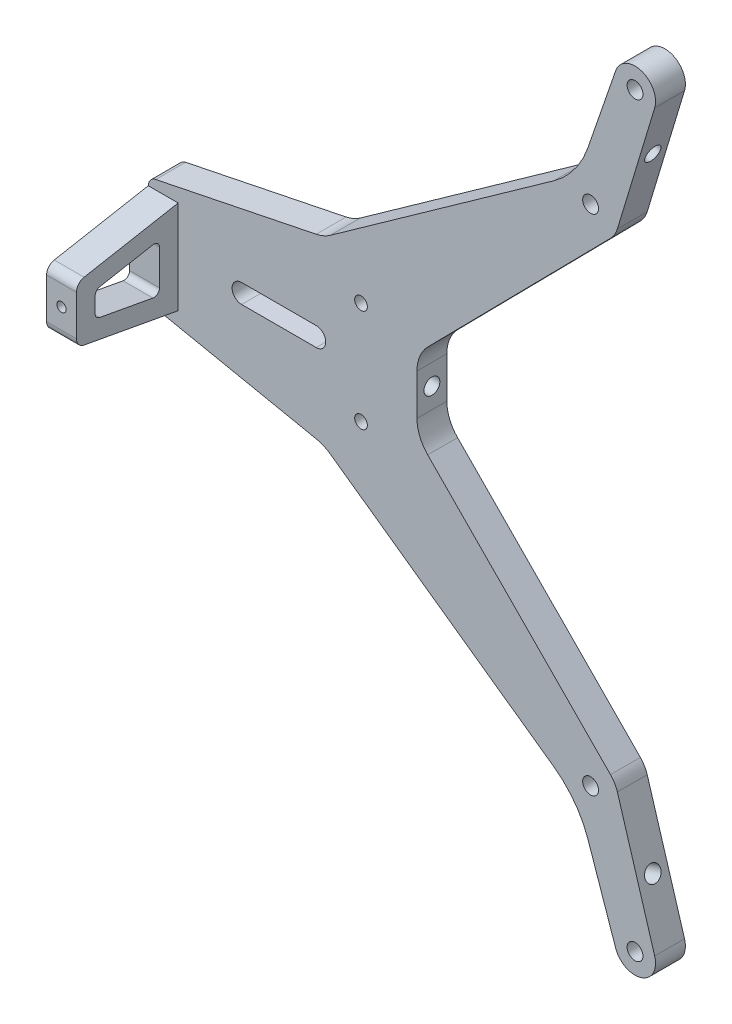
SolidWorks part; units mm, degrees
ref_plane "Plan de face" through (0, 0, 0) normal (0, 0, 1) x (1, 0, 0)
ref_plane "Plan de dessus" through (0, 0, 0) normal (0, 1, 0) x (1, 0, 0)
ref_plane "Plan de droite" through (0, 0, 0) normal (1, 0, 0) x (0, 0, -1)
sketch "Esquisse1" plane through (0, 0, 0) normal (0, 0, 1) x (1, 0, 0)
  line L0 (-218, 25) -> (-218, 15)
  line L1 (-74, 11) -> (-74, -11)
  line L2 (-450.4728, 0) -> (669.2457, 0) construction
  line L3 (-68.2463, 25.0372) -> (29.7295, 124.4721)
  line L4 (-120.4178, 50.796) -> (-0.6967, 135.9513)
  line L5 (33.4035, 130.6608) -> (53.396, 196.8179)
  line L6 (17.597, 160.4129) -> (32.4659, 203.5822)
  line L7 (-214.0025, 29.8985) -> (-128, 47.5)
  line L8 (-218, 15) -> (-202, 15)
  line L9 (-202, 15) -> (-202, -15)
  line L10 (-218, -15) -> (-202, -15)
  line L11 (-214.0025, -29.8985) -> (-128, -47.5)
  line L12 (17.597, -160.4129) -> (32.4659, -203.5822)
  line L13 (33.4035, -130.6608) -> (53.396, -196.8179)
  line L14 (-120.4178, -50.796) -> (-0.6967, -135.9513)
  line L15 (-68.2463, -25.0372) -> (29.7295, -124.4721)
  line L16 (-218, -25) -> (-218, -15)
  circle A0 centre (488, 0) radius 488 construction
  arc A1 (53.396, 196.8179) -> (32.4659, 203.5822) centre (42.8663, 200) ccw
  arc A2 (29.7295, -124.4721) -> (33.4035, -130.6608) centre (19.0448, -135) cw
  arc A3 (-74, 11) -> (-68.2463, 25.0372) centre (-54, 11) cw
  arc A4 (17.597, 160.4129) -> (-0.6967, 135.9513) centre (-29.6774, 176.6958) cw
  arc A5 (-120.4178, 50.796) -> (-128, 47.5) centre (-132.0101, 67.0938) cw
  arc A6 (-214.0025, 29.8985) -> (-218, 25) centre (-213, 25) ccw
  arc A7 (-214.0025, -29.8985) -> (-218, -25) centre (-213, -25) cw
  arc A8 (29.7295, 124.4721) -> (33.4035, 130.6608) centre (19.0448, 135) ccw
  arc A9 (-120.4178, -50.796) -> (-128, -47.5) centre (-132.0101, -67.0938) ccw
  arc A10 (17.597, -160.4129) -> (-0.6967, -135.9513) centre (-29.6774, -176.6958) ccw
  arc A11 (-74, -11) -> (-68.2463, -25.0372) centre (-54, -11) ccw
  arc A12 (53.396, -196.8179) -> (32.4659, -203.5822) centre (42.8663, -200) cw
  point P46 (-202, 0)
  point P47 (-74, 0)
  dimension "D1" = 976
  dimension "D2" = 200
  dimension "D3" = 22
  dimension "D4" = 15
  dimension "D6" = 218
  dimension "D8" = 20
  dimension "D12" = 50
  dimension "D14" = 20
  dimension "D13" = 5
  dimension "D5" = 135
  dimension "D7" = 144
  dimension "D9" = 11
  dimension "D10" = 10
  dimension "D11" = 9
  dimension "D15" = 25
  dimension "D16" = 47.5
  dimension "D17" = 90
  dimension "D18" = 16
  dimension "D19" = 15
extrude "Boss.-Extru.1" add sketch "Esquisse1" along normal mid plane 16
hole_wizard "Trou taraudé M105" positions "Esquisse16" profile "Esquisse15" tap size "M10" standard "Iso"
sketch "Esquisse16" plane through (-33.6613, 11.5941, 0) normal (-0.9455, 0.3257, 0) x (0, 0, 1)
  line L0 (8, 157.399) -> (-8, 157.399) construction
  line L1 (0, -149.5265) -> (0, 149.5265) construction
  point P0 (0, 172.399)
  dimension "D1" = 15
sketch "Esquisse15" plane through (22.4818, 174.5952, 0) normal (0, 0, 1) x (-0.3257, -0.9455, 0)
  line L0 (0, 0) -> (0, 266.4537)
  line L1 (0, 266.4537) -> (4.25, 263.9)
  line L2 (4.25, 263.9) -> (4.25, 0)
  line L5 (4.25, 0) -> (0, 0)
  line L10 (0, 266.4537) -> (-4.25, 263.9) construction
  line L11 (0, -6.35) -> (0, 107.95) construction
  dimension "Diamètre du trou pour taraudage" = 8.5
  dimension "Profondeur du trou pour taraudage" = 263.9
  dimension "Angle de pointe" = 118
hole_wizard "Trou taraudé M102" positions "Esquisse7" profile "Esquisse6" tap size "M10" standard "Iso"
sketch "Esquisse7" plane through (0, 0, 8) normal (0, 0, 1) x (1, 0, 0)
  arc A0 (53.396, 196.8179) -> (32.4659, 203.5822) centre (42.8663, 200) ccw construction
  arc A1 (29.7295, 124.4721) -> (33.4035, 130.6608) centre (19.0448, 135) ccw construction
  point P0 (42.8663, 200)
  point P2 (19.0448, 135)
sketch "Esquisse6" plane through (42.8663, 200, 8) normal (1, 0, 0) x (0, -1, 0)
  line L0 (0, 0) -> (0, 16.001)
  line L1 (0, 16.001) -> (4.25, 16.001)
  line L2 (4.25, 16.001) -> (4.25, 0)
  line L5 (4.25, 0) -> (0, 0)
  line L11 (0, -6.35) -> (0, 107.95) construction
  dimension "Diamètre du trou pour taraudage jusqu'au prochain" = 8.5
  dimension "Profondeur du trou pour taraudage jusqu'au prochain" = 16.001
hole_wizard "Trou taraudé M81" positions "Esquisse9" profile "Esquisse8" tap size "M8" standard "Iso"
sketch "Esquisse9" plane through (0, 0, 8) normal (0, 0, 1) x (1, 0, 0)
  line L0 (-218, 25) -> (-218, 15) construction
  point P0 (-104, 27.5)
  dimension "D1" = 114
  dimension "D2" = 27.5
sketch "Esquisse8" plane through (-104, 27.5, 8) normal (1, 0, 0) x (0, -1, 0)
  line L0 (0, 0) -> (0, 24.2929)
  line L1 (0, 24.2929) -> (3.4, 22.25)
  line L2 (3.4, 22.25) -> (3.4, 0)
  line L5 (3.4, 0) -> (0, 0)
  line L10 (0, 24.2929) -> (-3.4, 22.25) construction
  line L11 (0, -6.35) -> (0, 107.95) construction
  dimension "Diamètre du trou pour taraudage" = 6.8
  dimension "Profondeur du trou pour taraudage" = 22.25
  dimension "Angle de pointe" = 118
mirror "Symétrie1" about plane through (0, 0, 0) normal (0, 1, 0) of "Trou taraudé M105", "Trou taraudé M102", "Trou taraudé M81"
hole_wizard "Trou taraudé M103" positions "Esquisse11" profile "Esquisse10" tap size "M10" standard "Iso"
sketch "Esquisse11" plane through (-74, 0, 0) normal (1, 0, 0) x (0, 0, -1)
  point P0 (0, 0)
sketch "Esquisse10" plane through (-74, 0, 0) normal (0, 1, 0) x (0, 0, -1)
  line L0 (0, 0) -> (0, 27.5537)
  line L1 (0, 27.5537) -> (4.25, 25)
  line L2 (4.25, 25) -> (4.25, 0)
  line L5 (4.25, 0) -> (0, 0)
  line L10 (0, 27.5537) -> (-4.25, 25) construction
  line L11 (0, -6.35) -> (0, 107.95) construction
  dimension "Diamètre du trou pour taraudage" = 8.5
  dimension "Profondeur du trou pour taraudage" = 25
  dimension "Angle de pointe" = 118
sketch "Esquisse12" plane through (0, 0, 8) normal (0, 0, 1) x (1, 0, 0)
  line L0 (-168, 5.1) -> (-128, 5.1)
  line L1 (-168, -5.1) -> (-128, -5.1)
  line L2 (-218, 25) -> (-218, 15) construction
  arc A0 (-168, 5.1) -> (-168, -5.1) centre (-168, 0) ccw
  arc A1 (-128, -5.1) -> (-128, 5.1) centre (-128, 0) ccw
  dimension "D1" = 10.2
  dimension "D2" = 50
  dimension "D3" = 40
extrude "Enlèv. mat.-Extru.1" cut sketch "Esquisse12" against normal up to next
sketch "Esquisse19" plane through (-218, 0, 0) normal (-1, 0, 0) x (0, 0, 1)
  line L0 (8, 25) -> (8, 29.8985) construction
  line L13 (0, 231.4555) -> (0, -232.0429) construction
  line L14 (8, -25) -> (8, -15)
  line L15 (8, -15) -> (-3, -15)
  line L16 (8, 15) -> (8, 25)
  line L17 (8, 15) -> (-3, 15)
  line L18 (-3, -15) -> (-3, 15)
  line L19 (8, -25) -> (62.5, -15)
  line L20 (62.5, -15) -> (62.5, 15)
  line L21 (62.5, 15) -> (8, 25)
  line L22 (18, -12.9982) -> (18, 12.9982)
  line L23 (18, 12.9982) -> (52.5, 6.6679)
  line L24 (52.5, 6.6679) -> (52.5, -6.6679)
  line L26 (52.5, -6.6679) -> (18, -12.9982)
  point P0 (-3, 0)
  point P8 (62.5, 0)
  dimension "D6" = 30
  dimension "D7" = 50
  dimension "D1" = 10
  dimension "D2" = 10
  dimension "D3" = 10
  dimension "D4" = 10
  dimension "D5" = 30
  dimension "D8" = 25
  dimension "D10" = 65.5
  dimension "D11" = 11
  dimension "D12" = 10
extrude "Boss.-Extru.2" add sketch "Esquisse19" against normal up to surface (16 mm away)
fillet "Congé2" radius 3 4 edges at (-210, -12.9982, 18) (-210, -6.6679, 52.5) (-210, 6.6679, 52.5) (-210, 12.9982, 18)
fillet "Congé3" radius 5 2 edges at (-210, 15, 62.5) (-210, -15, 62.5)
hole_wizard "Trou taraudé M63" positions "Esquisse26" profile "Esquisse25" tap size "M6" standard "Iso"
sketch "Esquisse26" plane through (0, 0, 62.5) normal (0, 0, 1) x (1, 0, 0)
  line L0 (-218, -10.834) -> (-218, 10.834) construction
  point P0 (-210, 0)
  dimension "D1" = 8
sketch "Esquisse25" plane through (-210, 0, 62.5) normal (1, 0, 0) x (0, -1, 0)
  line L0 (0, 0) -> (0, 10)
  line L1 (0, 10) -> (2.5, 10)
  line L2 (2.5, 10) -> (2.5, 0)
  line L5 (2.5, 0) -> (0, 0)
  line L11 (0, -6.35) -> (0, 107.95) construction
  dimension "Diamètre du trou pour taraudage jusqu'au prochain" = 5
  dimension "Profondeur du trou pour taraudage jusqu'au prochain" = 10
